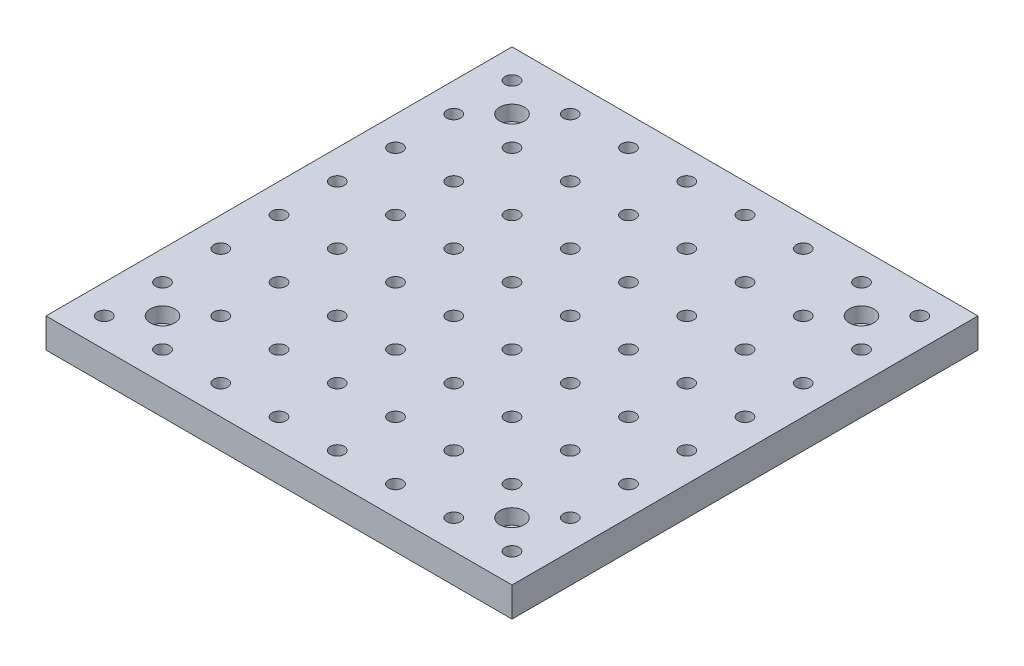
SolidWorks part; units mm, degrees
ref_plane "Front Plane" through (0, 0, 0) normal (0, 0, 1) x (1, 0, 0)
ref_plane "Top Plane" through (0, 0, 0) normal (0, 1, 0) x (1, 0, 0)
ref_plane "Right Plane" through (0, 0, 0) normal (1, 0, 0) x (0, 0, -1)
sketch "Sketch1" plane through (0, 0, 0) normal (0, 1, 0) x (1, 0, 0)
  line L0 (-87.5, 87.5) -> (-62.5, 87.5) construction
  line L1 (100, 100) -> (-100, 100)
  line L2 (100, 100) -> (100, -100)
  line L3 (100, -100) -> (-100, -100)
  line L4 (-100, 100) -> (-100, -100)
  line L5 (100, 100) -> (-100, -100) construction
  line L6 (100, -100) -> (-100, 100) construction
  line L7 (-87.5, 87.5) -> (-87.5, 62.5) construction
  circle A0 centre (-87.5, 87.5) radius 3
  circle A1 centre (-62.5, 87.5) radius 3
  circle A2 centre (-37.5, 87.5) radius 3
  circle A3 centre (-12.5, 87.5) radius 3
  circle A4 centre (12.5, 87.5) radius 3
  circle A5 centre (37.5, 87.5) radius 3
  circle A6 centre (62.5, 87.5) radius 3
  circle A7 centre (87.5, 87.5) radius 3
  circle A8 centre (-62.5, 62.5) radius 3
  circle A9 centre (-37.5, 62.5) radius 3
  circle A10 centre (-12.5, 62.5) radius 3
  circle A11 centre (12.5, 62.5) radius 3
  circle A12 centre (37.5, 62.5) radius 3
  circle A13 centre (62.5, 62.5) radius 3
  circle A14 centre (87.5, 62.5) radius 3
  circle A15 centre (-62.5, 37.5) radius 3
  circle A16 centre (-37.5, 37.5) radius 3
  circle A17 centre (-12.5, 37.5) radius 3
  circle A18 centre (12.5, 37.5) radius 3
  circle A19 centre (37.5, 37.5) radius 3
  circle A20 centre (62.5, 37.5) radius 3
  circle A21 centre (87.5, 37.5) radius 3
  circle A22 centre (-62.5, 12.5) radius 3
  circle A23 centre (-37.5, 12.5) radius 3
  circle A24 centre (-12.5, 12.5) radius 3
  circle A25 centre (12.5, 12.5) radius 3
  circle A26 centre (37.5, 12.5) radius 3
  circle A27 centre (62.5, 12.5) radius 3
  circle A28 centre (87.5, 12.5) radius 3
  circle A29 centre (-62.5, -12.5) radius 3
  circle A30 centre (-37.5, -12.5) radius 3
  circle A31 centre (-12.5, -12.5) radius 3
  circle A32 centre (12.5, -12.5) radius 3
  circle A33 centre (37.5, -12.5) radius 3
  circle A34 centre (62.5, -12.5) radius 3
  circle A35 centre (87.5, -12.5) radius 3
  circle A36 centre (-62.5, -37.5) radius 3
  circle A37 centre (-37.5, -37.5) radius 3
  circle A38 centre (-12.5, -37.5) radius 3
  circle A39 centre (12.5, -37.5) radius 3
  circle A40 centre (37.5, -37.5) radius 3
  circle A41 centre (62.5, -37.5) radius 3
  circle A42 centre (87.5, -37.5) radius 3
  circle A43 centre (-62.5, -62.5) radius 3
  circle A44 centre (-37.5, -62.5) radius 3
  circle A45 centre (-12.5, -62.5) radius 3
  circle A46 centre (12.5, -62.5) radius 3
  circle A47 centre (37.5, -62.5) radius 3
  circle A48 centre (62.5, -62.5) radius 3
  circle A49 centre (87.5, -62.5) radius 3
  circle A50 centre (-62.5, -87.5) radius 3
  circle A51 centre (-37.5, -87.5) radius 3
  circle A52 centre (-12.5, -87.5) radius 3
  circle A53 centre (12.5, -87.5) radius 3
  circle A54 centre (37.5, -87.5) radius 3
  circle A55 centre (62.5, -87.5) radius 3
  circle A56 centre (87.5, -87.5) radius 3
  circle A57 centre (-87.5, 62.5) radius 3
  circle A58 centre (-87.5, 37.5) radius 3
  circle A59 centre (-87.5, 12.5) radius 3
  circle A60 centre (-87.5, -12.5) radius 3
  circle A61 centre (-87.5, -37.5) radius 3
  circle A62 centre (-87.5, -62.5) radius 3
  circle A63 centre (-87.5, -87.5) radius 3
  point P0 (0, 0)
  point P8 (-87.5186, 62.5)
  point P9 (0, 0)
  dimension "D3" = 6
  dimension "D1" = 200
  dimension "D2" = 12.5
  dimension "D6" = 25
  dimension "D7" = 25
  dimension "D4" = 8
  dimension "D5" = 8
extrude "Boss-Extrude1" add sketch "Sketch1" against normal blind 12.7
sketch "Sketch2" plane through (0, 0, 0) normal (0, 1, 0) x (1, 0, 0)
  line L0 (-100, 100) -> (-100, -100) construction
  line L1 (-100, -100) -> (100, -100) construction
  line L2 (-75, -75) -> (75, -75) construction
  circle A0 centre (-75, -75) radius 5.25
  circle A1 centre (75, -75) radius 5.25
  circle A2 centre (75, 75) radius 5.25
  circle A3 centre (-75, 75) radius 5.25
  point P6 (0, 0)
  point P7 (0, 0)
  dimension "D1" = 10.5
  dimension "D2" = 25
  dimension "D3" = 25
  dimension "D6" = 150
  dimension "D7" = 150
  dimension "D4" = 2
  dimension "D5" = 2
extrude "Cut-Extrude1" cut sketch "Sketch2" against normal blind 6.5
sketch "Sketch3" plane through (0, -6.5, 0) normal (0, 1, 0) x (1, 0, 0)
  circle A0 centre (-75, -75) radius 1.65
  circle A1 centre (-75, -75) radius 5.25 construction
  point P2 (-74.9024, -75.8199)
  point P5 (0, 0)
  dimension "D1" = 3.3
extrude "Cut-Extrude2" cut sketch "Sketch3" against normal through all both and the other way through all
mirror "Mirror1" about plane through (0, 0, 0) normal (1, 0, 0) of "Cut-Extrude2"
